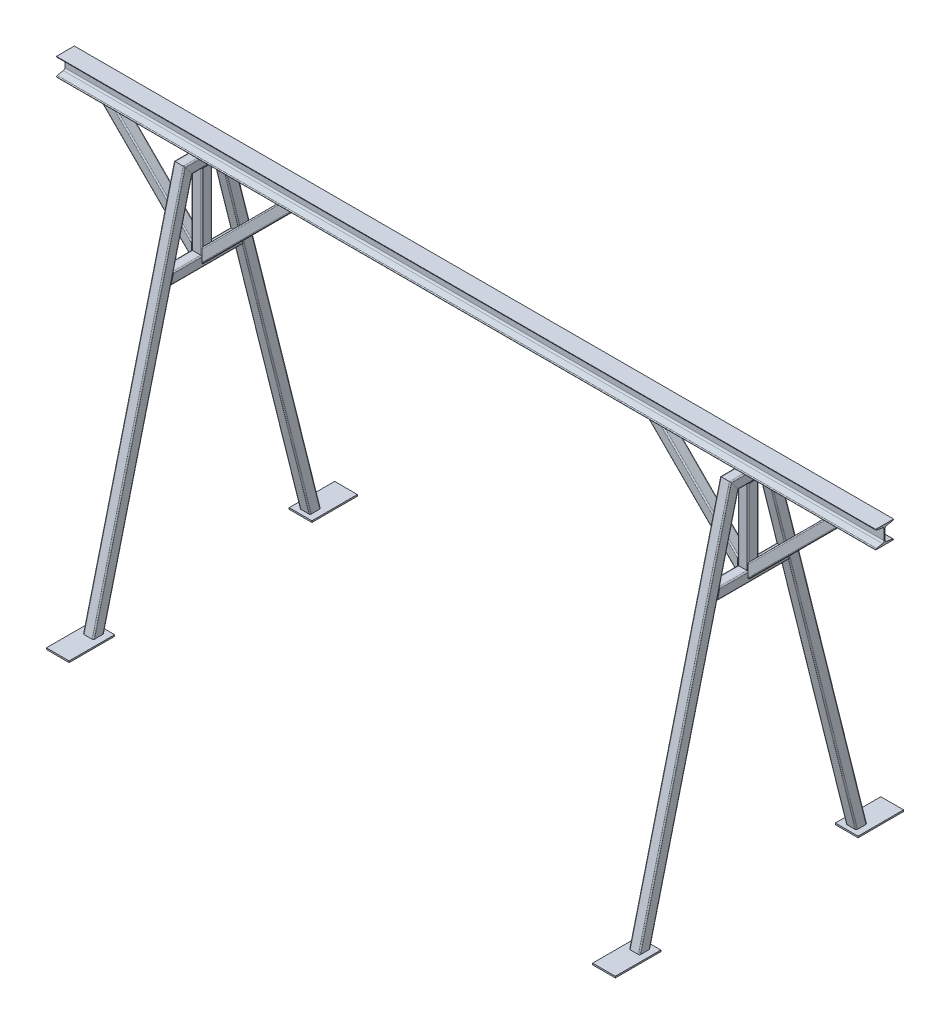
SolidWorks part; units mm, degrees
ref_plane "Front Plane" through (0, 0, 0) normal (0, 0, 1) x (1, 0, 0)
ref_plane "Top Plane" through (0, 0, 0) normal (0, 1, 0) x (1, 0, 0)
ref_plane "Right Plane" through (0, 0, 0) normal (1, 0, 0) x (0, 0, -1)
sketch "FootPrint" plane through (0, 0, 0) normal (0, 1, 0) x (1, 0, 0)
  line L1 (-1828.8, -762) -> (1828.8, -762) construction
  line L2 (-1828.8, -762) -> (-1828.8, 762) construction
  line L3 (-1828.8, 762) -> (1828.8, 762) construction
  line L4 (1828.8, -762) -> (1828.8, 762) construction
  line L5 (-1828.8, -762) -> (1828.8, 762) construction
  line L6 (-1828.8, 762) -> (1828.8, -762) construction
  point P0 (0, 0)
  dimension "D1" = 3657.6
  dimension "D2" = 1524
ref_plane "Plane1" through (-1828.8, 0, 0) normal (1, 0, 0) x (0, 0, -1)
sketch "Side Layout" plane through (-1828.8, 0, 0) normal (1, 0, 0) x (0, 0, -1)
  line L0 (0, 0) -> (0, 2438.4) construction
  line L1 (-762, 0) -> (762, 0) construction
  line L2 (-762, 0) -> (-152.4, 2438.4)
  line L3 (-152.4, 2438.4) -> (152.4, 2438.4)
  line L4 (-304.8, 1828.8) -> (304.8, 1828.8)
  line L5 (0, 2438.4) -> (0, 1828.8)
  line L6 (762, 0) -> (152.4, 2438.4)
  dimension "D1" = 2438.4
  dimension "D2" = 609.6
  dimension "D3" = 304.8
sketch "Top Bar Layout" plane through (0, 0, 0) normal (0, 0, 1) x (1, 0, 0)
  line L0 (-2743.2, 2438.4) -> (2743.2, 2438.4)
  line L1 (0, 0) -> (0, 2438.4) construction
  line L2 (-2438.4, 2438.4) -> (-1828.8, 1828.8)
  line L3 (-1828.8, 2438.4) -> (-1828.8, 1828.8) construction
  dimension "D1" = 5486.4
  dimension "D2" = 45
other "Tube (square) 70 X 70 X 4.0(1)"
ref_plane "Plane2" through (-1828.8, 0, 762) normal (0, 0.9701, -0.2425) x (0, 0.2425, 0.9701)
sketch "Sketch1" plane through (-1828.8, 0, 762) normal (0, 0.9701, -0.2425) x (0, 0.2425, 0.9701)
  line L0 (-27, -31) -> (27, -31)
  line L1 (-31, -27) -> (-31, 27)
  line L2 (27, 31) -> (-27, 31)
  line L3 (31, 27) -> (31, -27)
  line L4 (-27, -35) -> (27, -35)
  line L5 (-35, -27) -> (-35, 27)
  line L6 (27, 35) -> (-27, 35)
  line L7 (35, 27) -> (35, -27)
  line L8 (-35, 0) -> (-31, 0) construction
  line L9 (-31, 0) -> (31, 0) construction
  line L10 (31, 0) -> (35, 0) construction
  line L12 (0, 35) -> (0, 31) construction
  line L13 (0, 31) -> (0, -31) construction
  line L14 (0, -31) -> (0, -35) construction
  arc A0 (35, 27) -> (27, 35) centre (27, 27) ccw
  arc A1 (27, -35) -> (35, -27) centre (27, -27) ccw
  arc A2 (-35, -27) -> (-27, -35) centre (-27, -27) ccw
  arc A3 (-27, 35) -> (-35, 27) centre (-27, 27) ccw
  arc A4 (-27, 31) -> (-31, 27) centre (-27, 27) ccw
  arc A5 (31, 27) -> (27, 31) centre (27, 27) ccw
  arc A6 (27, -31) -> (31, -27) centre (27, -27) ccw
  arc A7 (-31, -27) -> (-27, -31) centre (-27, -27) ccw
  point P2 (-35, 35)
  point P33 (-35, -35)
  point P34 (35, -35)
  point P36 (35, 35)
  point P37 (0, 0)
  dimension "D1" = 8
  dimension "Thickness" = 4
  dimension "V_leg" = 70
  dimension "H_leg" = 70
mirror "Mirror1" about plane through (-1828.8, 0, 0) normal (1, 0, 0)
mirror "Mirror2" about plane through (0, 0, 0) normal (1, 0, 0)
other "Sc beam SC 120(1)"
ref_plane "Plane3" through (-2743.2, 2438.4, 0) normal (1, 0, 0) x (0, 1, 0)
sketch "Sketch11" plane through (-2743.2, 2438.4, 0) normal (1, 0, 0) x (0, 1, 0)
  line L0 (-60, -60) -> (-60, -58.8122)
  line L1 (-54.9865, -52.8939) -> (-13.2771, -45.9418)
  line L2 (-3.25, -34.1051) -> (-3.25, 34.1051)
  line L3 (-13.2771, 45.9418) -> (-54.9865, 52.8939)
  line L4 (-60, 58.8122) -> (-60, 60)
  line L5 (-60, 60) -> (60, 60)
  line L6 (60, 60) -> (60, 58.8122)
  line L7 (54.9865, 52.8939) -> (13.2771, 45.9418)
  line L8 (3.25, 34.1051) -> (3.25, -34.1051)
  line L9 (13.2771, -45.9418) -> (54.9865, -52.8939)
  line L10 (60, -58.8122) -> (60, -60)
  line L11 (60, -60) -> (-60, -60)
  line L14 (60, -49) -> (0, -49) construction
  line L15 (0, 60) -> (0, -60) construction
  line L16 (-3.25, 0) -> (3.25, 0) construction
  arc A0 (-13.2771, -45.9418) -> (-3.25, -34.1051) centre (-15.25, -34.1051) ccw
  arc A1 (-3.25, 34.1051) -> (-13.2771, 45.9418) centre (-15.25, 34.1051) ccw
  arc A2 (13.2771, 45.9418) -> (3.25, 34.1051) centre (15.25, 34.1051) ccw
  arc A3 (3.25, -34.1051) -> (13.2771, -45.9418) centre (15.25, -34.1051) ccw
  arc A4 (60, -58.8122) -> (54.9865, -52.8939) centre (54, -58.8122) ccw
  arc A5 (-60, -58.8122) -> (-54.9865, -52.8939) centre (-54, -58.8122) cw
  arc A6 (-54.9865, 52.8939) -> (-60, 58.8122) centre (-54, 58.8122) cw
  arc A7 (54.9865, 52.8939) -> (60, 58.8122) centre (54, 58.8122) ccw
  point P35 (0, 0)
  dimension "D7" = 9.463
  dimension "RI" = 12
  dimension "RA" = 6
  dimension "BF" = 120
  dimension "D6" = 9.463
  dimension "DEPTH" = 120
  dimension "TW" = 6.5
  dimension "D1" = 68.2102
  dimension "TF" = 11
other "Trim/Extend1"
sketch "Sketch12" plane through (0, 0, 0) normal (0, 1, 0) x (1, 0, 0)
  line L0 (-1828.8, -762) -> (-1828.8, -965.2) construction
  line L1 (-1905, -660.4) -> (-1752.6, -660.4)
  line L2 (-1905, -660.4) -> (-1905, -965.2)
  line L3 (-1905, -965.2) -> (-1752.6, -965.2)
  line L4 (-1752.6, -660.4) -> (-1752.6, -965.2)
  dimension "D1" = 203.2
  dimension "D2" = 152.4
  dimension "D3" = 304.8
extrude "Foot Plate" add sketch "Sketch12" against normal blind 10 separate body
mirror "Mirror3" about plane through (0, 0, 0) normal (1, 0, 0)
mirror "Mirror4" about plane through (0, 0, 0) normal (0, 0, 1)
other "Trim/Extend2"
